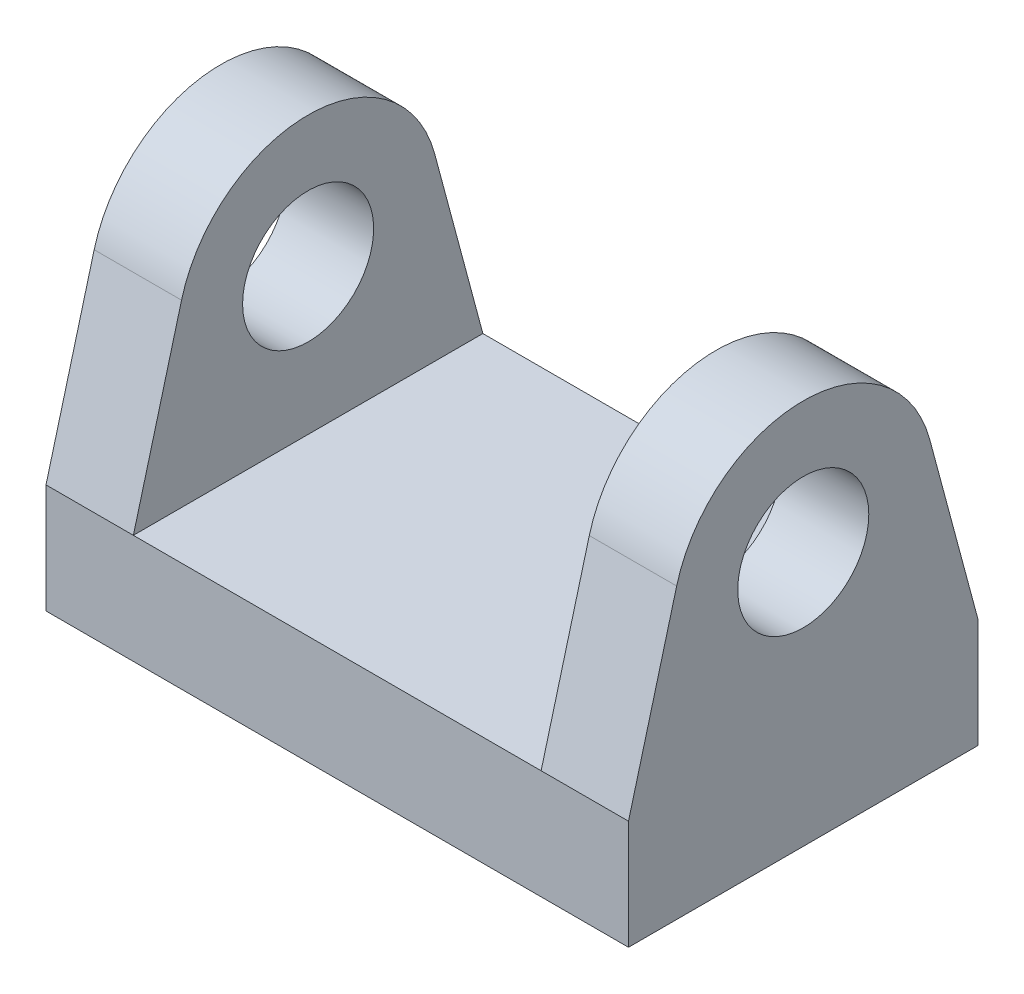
SolidWorks part; units mm, degrees
ref_plane "Front Plane" through (0, 0, 0) normal (0, 0, 1) x (1, 0, 0)
ref_plane "Top Plane" through (0, 0, 0) normal (0, 1, 0) x (1, 0, 0)
ref_plane "Right Plane" through (0, 0, 0) normal (1, 0, 0) x (0, 0, -1)
imported_body "Imported3"
sketch "Sketch1" plane through (0, 7.5, 0) normal (0, -1, 0) x (1, 0, 0)
  line L0 (-14, 12) -> (14, 12)
  line L1 (14, 12) -> (14, -12)
  line L2 (14, -12) -> (-14, -12)
  line L3 (-14, -12) -> (-14, 12)
extrude "Boss-Extrude1" add sketch "Sketch1" along normal blind 7.5
sketch "Sketch2" plane through (-14, 0, 0) normal (-1, 0, 0) x (0, 0, 1)
  line L0 (12, 0) -> (-12, 0)
  line L1 (-12, 0) -> (-12, 7.5)
  line L2 (-12, 7.5) -> (-8.6928, 19.8314)
  line L3 (8.6928, 19.8314) -> (12, 7.5)
  line L4 (12, 7.5) -> (12, 0)
  arc A0 (-8.6928, 19.8314) -> (8.6928, 19.8314) centre (0, 17.5) cw
extrude "Boss-Extrude2" add sketch "Sketch2" along normal blind 6
sketch "Sketch3" plane through (14, 0, 0) normal (1, 0, 0) x (0, 0, -1)
  line L0 (12, 0) -> (-12, 0)
  line L1 (-12, 0) -> (-12, 7.5)
  line L2 (-12, 7.5) -> (-8.6928, 19.8314)
  line L3 (8.6928, 19.8314) -> (12, 7.5)
  line L4 (12, 7.5) -> (12, 0)
  arc A0 (-8.6928, 19.8314) -> (8.6928, 19.8314) centre (0, 17.5) cw
extrude "Boss-Extrude3" add sketch "Sketch3" along normal blind 6
ref_plane "Plane1" through (-14, 0, 0) normal (-1, 0, 0) x (0, -1, 0)
sketch "Sketch4" plane through (-14, 0, 0) normal (-1, 0, 0) x (0, -1, 0)
  line L0 (-7.5, 12) -> (-19.8314, 8.6928)
  line L1 (-19.8314, -8.6928) -> (-7.5, -12)
  line L2 (-7.5, -12) -> (-7.5, 12)
  arc A0 (-19.8314, 8.6928) -> (-19.8314, -8.6928) centre (-17.5, 0) ccw
extrude "Cut-Extrude1" cut sketch "Sketch4" against normal blind 28
hole_wizard "Ø9.0 (9) Diameter Hole1" positions "Sketch6" profile "Sketch5" hole size "Ø9.0" standard "ANSI Metric"
sketch "Sketch6" plane through (20, 0, 0) normal (1, 0, 0) x (0, 0, -1)
  point P0 (0, 17.5)
sketch "Sketch5" plane through (20, 17.5, 0) normal (0, 1, 0) x (0, 0, -1)
  line L0 (0, 0) -> (0, 6)
  line L1 (0, 6) -> (4.5, 6)
  line L2 (4.5, 6) -> (4.5, 0)
  line L5 (4.5, 0) -> (0, 0)
  line L11 (0, -6.35) -> (0, 107.95) construction
  dimension "Thru Hole Dia." = 9
  dimension "Thru Hole Depth" = 6
hole_wizard "Ø9.0 (9) Diameter Hole2" positions "Sketch8" profile "Sketch7" hole size "Ø9.0" standard "ANSI Metric"
sketch "Sketch8" plane through (-20, 0, 0) normal (-1, 0, 0) x (0, 0, 1)
  point P0 (0, 17.5)
sketch "Sketch7" plane through (-20, 17.5, 0) normal (0, 1, 0) x (0, 0, 1)
  line L0 (0, 0) -> (0, 40)
  line L1 (0, 40) -> (4.5, 40)
  line L2 (4.5, 40) -> (4.5, 0)
  line L5 (4.5, 0) -> (0, 0)
  line L11 (0, -6.35) -> (0, 107.95) construction
  dimension "Thru Hole Dia." = 9
  dimension "Thru Hole Depth" = 40
